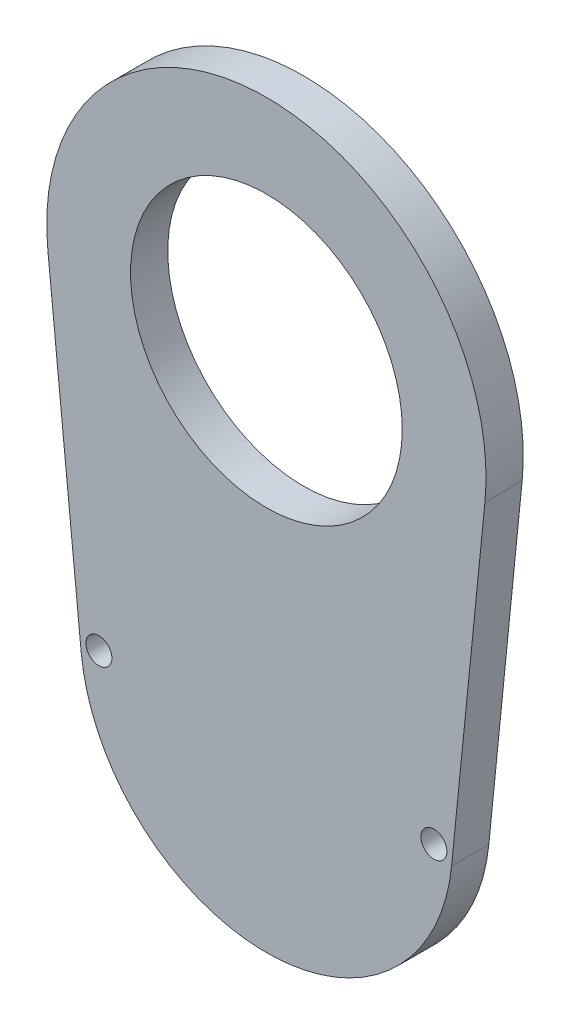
SolidWorks part; units mm, degrees
ref_plane "Front" through (0, 0, 0) normal (0, 0, 1) x (1, 0, 0)
ref_plane "Top" through (0, 0, 0) normal (0, 1, 0) x (1, 0, 0)
ref_plane "Right" through (0, 0, 0) normal (1, 0, 0) x (0, 0, -1)
sketch "Sketch Cover" plane through (0, 0, 0) normal (0, 0, 1) x (1, 0, 0)
  line L1 (-14.9109, -1.4986) -> (-12.6363, -24.13)
  line L2 (0, 42.6536) -> (0, -58.1688) construction
  line L3 (14.9109, -1.4986) -> (12.6363, -24.13)
  circle A0 centre (0, 0) radius 14.986
  circle A1 centre (0, 0) radius 9.271
  circle A2 centre (0, -22.86) radius 12.7
  circle A3 centre (-11.43, -23.4329) radius 0.889
  circle A4 centre (11.43, -23.4329) radius 0.889
  dimension "D1" = 29.972
  dimension "D2" = 1.778
  dimension "D3" = 18.542
  dimension "D4" = 25.4
  dimension "D5" = 22.86
  dimension "D6" = 1.27
  dimension "D7" = 11.43
extrude "Boss-Extrude Cover" add sketch "Sketch Cover" along normal blind 2.54 contours A0 L2 A2 A4 | L2 A0 A2 A3 | A3 A2 A0 L1 | L2 A2 A0 | A2 L2 A0 | A2 A4 L3 A0 | A0 L2 A1 A2 | L2 A0 A2 A1
